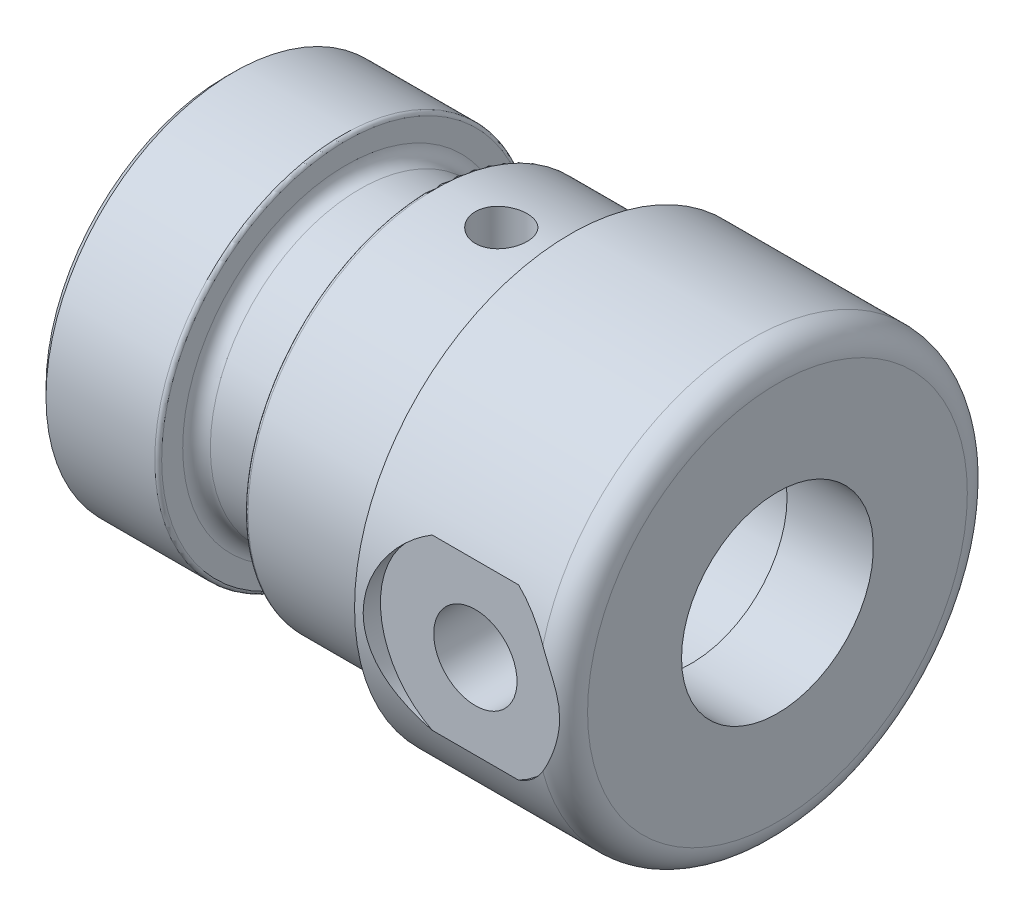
SolidWorks part; units mm, degrees
ref_plane "Plane1" through (0, 0, 0) normal (0, 0, 1) x (1, 0, 0)
ref_plane "Plane2" through (0, 0, 0) normal (0, 1, 0) x (1, 0, 0)
ref_plane "Plane3" through (0, 0, 0) normal (1, 0, 0) x (0, 0, -1)
sketch "Sketch1" plane through (0, 0, 0) normal (0, 0, 1) x (1, 0, 0)
  line L0 (0, 0) -> (60, 0) construction
  line L6 (0, 5.5562) -> (0, 10.875)
  line L10 (7, 8.655) -> (12, 8.655)
  line L13 (7, 10.875) -> (7, 8.655)
  line L15 (12, 8.655) -> (12, 10.875)
  line L16 (12, 10.875) -> (20, 10.875)
  line L22 (0, 10.875) -> (7, 10.875)
  line L23 (20, 10.875) -> (20, 12.5)
  line L24 (20, 12.5) -> (32, 12.5)
  line L25 (32, 12.5) -> (32, 5.5563)
  line L26 (32, 5.5563) -> (0, 5.5562)
  dimension "D2" = 2.22
  dimension "D3" = 7
  dimension "D4" = 21.75
  dimension "D5" = 20
  dimension "D7" = 5
  dimension "D12" = 12
  dimension "D13" = 25
  dimension "D14" = 11.1125
revolve "Base-Revolve" add sketch "Sketch1" angle 360 about L0
chamfer "Chamfer1" distance 0.5 angle 45
ref_plane "Plane4" through (0, 11.125, 0) normal (0, 1, 0) x (-1, 0, 0)
hole_wizard "M3.0 (3.000000) Diameter Hole4" positions "Sketch9" profile "Sketch8" hole size "M3.0" standard "ISO"
sketch "Sketch9" plane through (0, 11.125, 0) normal (0, 1, 0) x (-1, 0, 0)
  line L0 (0, 0) -> (-60, 0) construction
  line L1 (-20, -12.5) -> (-20, 12.5) construction
  point P0 (-16, 0)
  dimension "D1" = 4
sketch "Sketch8" plane through (16, 11.125, 0) normal (1, 0, 0) x (0, 0, 1)
  line L0 (0, 0) -> (0, 4.9013)
  line L1 (0, 4.9013) -> (1.5, 4)
  line L2 (1.5, 4) -> (1.5, 0)
  line L5 (1.5, 0) -> (0, 0)
  line L10 (0, 4.9013) -> (-1.5, 4) construction
  line L11 (0, -6.35) -> (0, 107.95) construction
  dimension "Hole Dia." = 3
  dimension "Hole Depth" = 4
  dimension "Drill Angle" = 118
fillet "Fillet1" radius 1.5
fillet "Fillet2" radius 0.8
fillet "Fillet3" radius 0.2
pattern_circular "CirPattern1" count 2 over 360 about axis through (0, 0, 0) along (1, 0, 0)
sketch "Sketch10" plane through (0, 0, 0) normal (-1, 0, 0) x (0, 0, 1)
  circle A0 centre (0, 0) radius 6
  dimension "D1" = 12
extrude "Cut-Extrude1" cut sketch "Sketch10" against normal blind 27
ref_plane "Plane5" through (0, 0, 13) normal (0, 0, 1) x (1, 0, 0)
sketch "Sketch11" plane through (0, 0, 13) normal (0, 0, 1) x (1, 0, 0)
  line L0 (27, 0) -> (0, 0) construction
  line L1 (32, -11) -> (32, 11) construction
  circle A0 centre (26, 0) radius 5.5
  dimension "D1" = 11
  dimension "D2" = 6
extrude "Cut-Extrude2" cut sketch "Sketch11" against normal blind 1.5
ref_plane "Plane6" through (0, 0, 2.5) normal (0, 0, 1) x (1, 0, 0)
hole_wizard "#10-32 Tapped Hole1" positions "Sketch13" profile "Sketch12" tap size "#10-32" standard "Ansi Inch"
sketch "Sketch13" plane through (0, 0, 11.5) normal (0, 0, 1) x (1, 0, 0)
  arc A0 (30.5, -3.1623) -> (30.5, 3.1623) centre (26, 0) ccw construction
  point P0 (26, 0)
sketch "Sketch12" plane through (26, 0, 11.5) normal (1, 0, 0) x (0, -1, 0)
  line L0 (0, 0) -> (0, 15.1757)
  line L1 (0, 15.1757) -> (2.0193, 13.9624)
  line L2 (2.0193, 13.9624) -> (2.0193, 10)
  line L3 (2.0193, 10) -> (2.413, 10)
  line L4 (2.413, 10) -> (2.413, 0)
  line L5 (2.413, 0) -> (0, 0)
  line L10 (0, 15.1757) -> (-2.0193, 13.9624) construction
  line L11 (0, -6.35) -> (0, 107.95) construction
  dimension "Tap Drill Dia." = 4.0386
  dimension "Tap Drill Depth" = 13.9624
  dimension "Thread Major Dia." = 4.826
  dimension "Thread Depth" = 10
  dimension "Drill Angle" = 118
